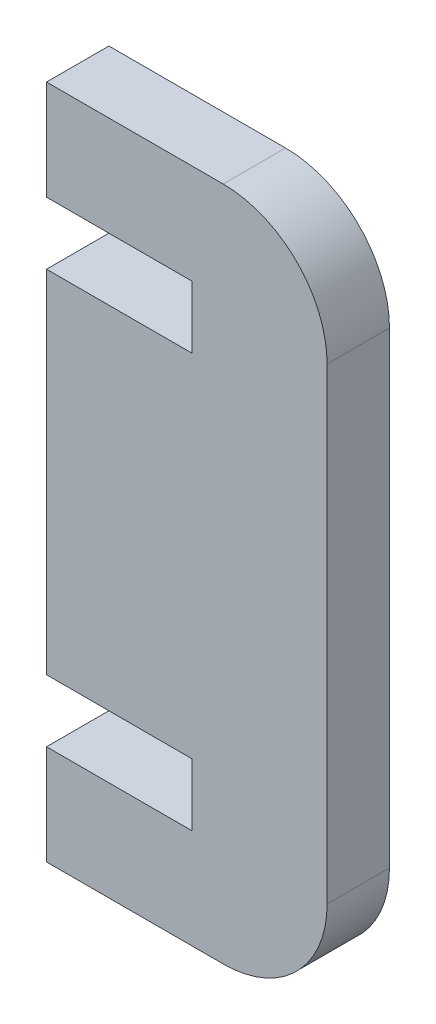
SolidWorks part; units mm, degrees
ref_plane "Alzado" through (0, 0, 0) normal (0, 0, 1) x (1, 0, 0)
ref_plane "Planta" through (0, 0, 0) normal (0, 1, 0) x (1, 0, 0)
ref_plane "Vista lateral" through (0, 0, 0) normal (1, 0, 0) x (0, 0, -1)
sketch "Sketch1" plane through (0, 0, 0) normal (0, 0, 1) x (1, 0, 0)
  line L0 (-6.75, 8.45) -> (-6.75, -8.45)
  line L1 (-6.75, 16.25) -> (1.75, 16.25)
  line L2 (-6.75, 16.25) -> (-6.75, 11.45)
  line L3 (-6.75, -16.25) -> (1.75, -16.25)
  line L4 (6.75, 11.25) -> (6.75, -11.25)
  line L5 (-6.75, 16.25) -> (6.75, -16.25) construction
  line L6 (-6.75, -16.25) -> (6.75, 16.25) construction
  line L7 (-6.75, 11.45) -> (0.25, 11.45)
  line L9 (-6.75, 8.45) -> (0.25, 8.45)
  line L10 (0.25, 11.45) -> (0.25, 8.45)
  line L11 (-6.75, -8.45) -> (0.25, -8.45)
  line L13 (-6.75, -11.45) -> (0.25, -11.45)
  line L14 (0.25, -8.45) -> (0.25, -11.45)
  line L15 (-6.75, -11.45) -> (-6.75, -16.25)
  arc A0 (6.75, 11.25) -> (1.75, 16.25) centre (1.75, 11.25) ccw
  arc A1 (6.75, -11.25) -> (1.75, -16.25) centre (1.75, -11.25) cw
  point P0 (0, 0)
  dimension "D9" = 5
  dimension "D10" = 5
  dimension "D1" = 32.5
  dimension "D2" = 13.5
  dimension "D3" = 3
  dimension "D4" = 7
  dimension "D5" = 4.8
  dimension "D6" = 4.8
  dimension "D7" = 3
  dimension "D8" = 7
extrude "Boss-Extrude1" add sketch "Sketch1" along normal blind 3
